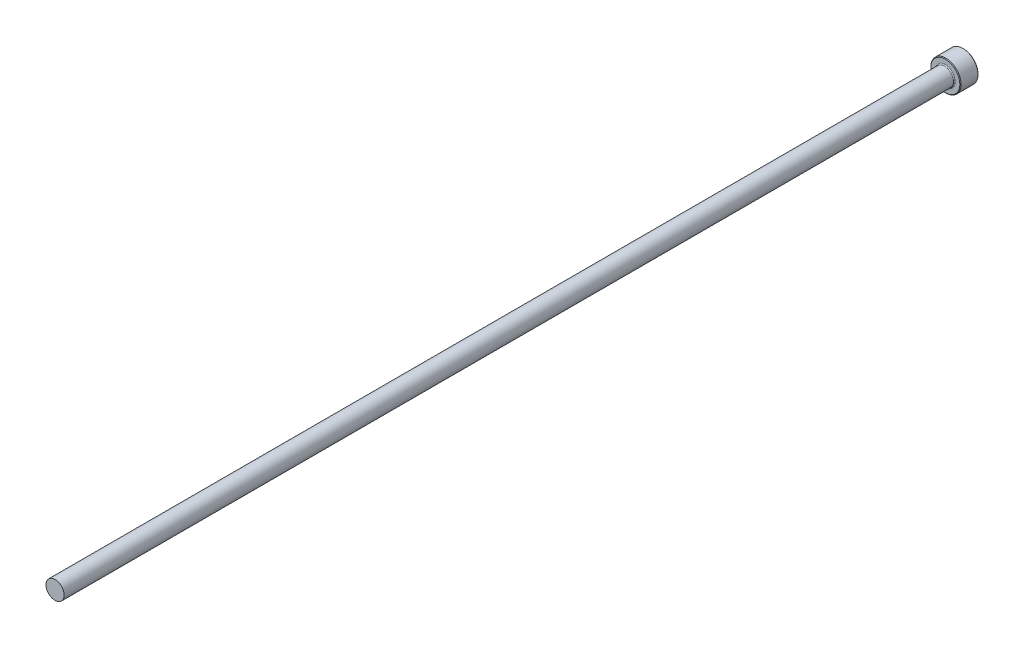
SolidWorks part; units mm, degrees
ref_plane "Front Plane" through (0, 0, 0) normal (0, 0, 1) x (1, 0, 0)
ref_plane "Top Plane" through (0, 0, 0) normal (0, 1, 0) x (1, 0, 0)
ref_plane "Right Plane" through (0, 0, 0) normal (1, 0, 0) x (0, 0, -1)
sketch "Sketch1" plane through (0, 0, 0) normal (1, 0, 0) x (0, 0, -1)
  line L0 (0, 0) -> (0, 5)
  line L1 (0, 5.5) -> (0, -5.5) construction
  line L2 (0, 5) -> (-6, 5)
  line L3 (-6, 5) -> (-6, 3.3)
  line L4 (-6.3, 3) -> (-300, 3)
  line L5 (-300, 3) -> (-300, 0)
  line L6 (5.5, 0) -> (-5.5, 0) construction
  line L7 (-300, 0) -> (0, 0)
  line L8 (-109.0506, 0) -> (16.9928, 0) construction
  arc A0 (-6, 3.3) -> (-6.3, 3) centre (-6.3, 3.3) cw
  dimension "D1" = 0.3
  dimension "D2" = 10
  dimension "D3" = 6
  dimension "D4" = 300
  dimension "D5" = 6
revolve "Revolve1" add sketch "Sketch1" angle 360 about L8
chamfer "Chamfer1" distance 0.2 angle 45 2 edges at (5, 0, 0) (5, 0, 6)
